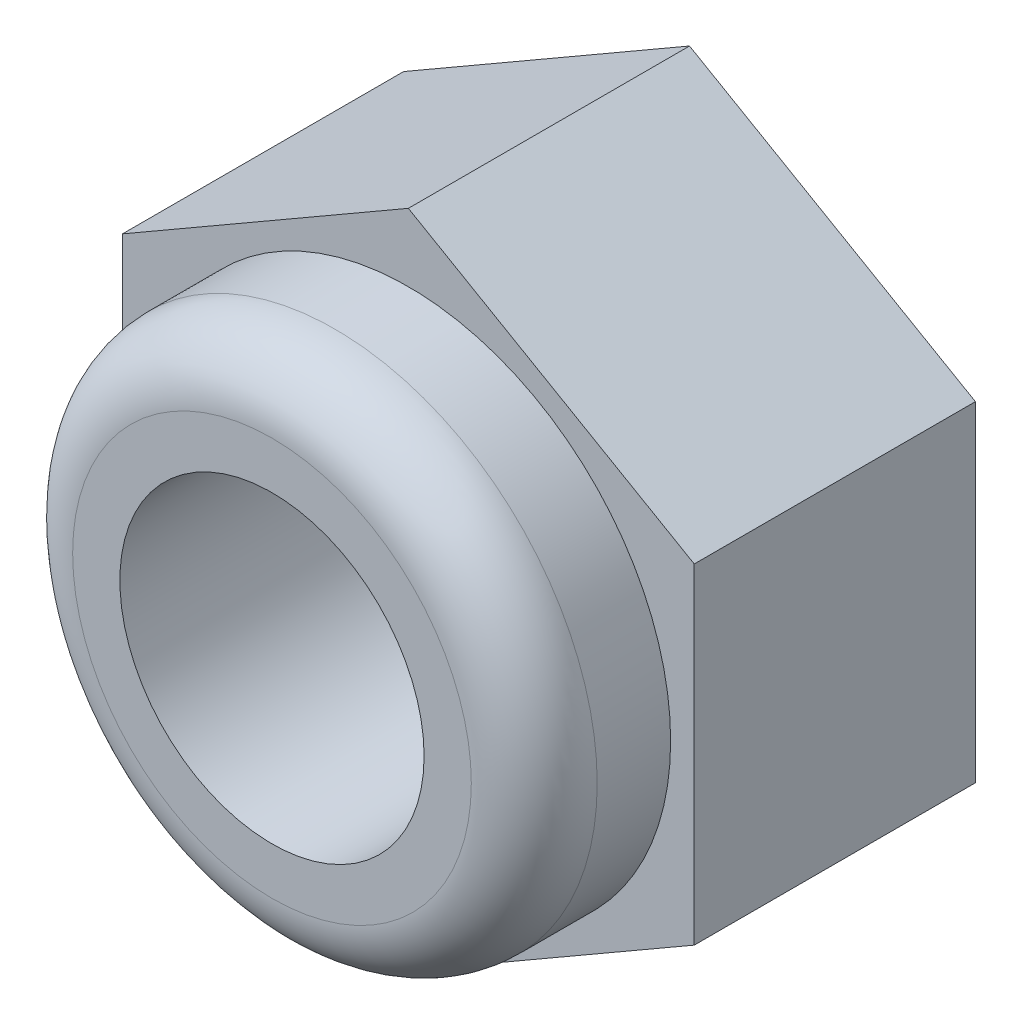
SolidWorks part; units mm, degrees
ref_plane "Plan de face" through (0, 0, 0) normal (0, 0, 1) x (1, 0, 0)
ref_plane "Plan de dessus" through (0, 0, 0) normal (0, 1, 0) x (1, 0, 0)
ref_plane "Plan de droite" through (0, 0, 0) normal (1, 0, 0) x (0, 0, -1)
sketch "Esquisse1" plane through (0, 0, 0) normal (0, 0, 1) x (1, 0, 0)
  line L1 (0, 3.1466) -> (-2.725, 1.5733)
  line L2 (-2.725, 1.5733) -> (-2.725, -1.5733)
  line L3 (-2.725, -1.5733) -> (0, -3.1466)
  line L4 (0, -3.1466) -> (2.725, -1.5733)
  line L5 (2.725, -1.5733) -> (2.725, 1.5733)
  line L6 (2.725, 1.5733) -> (0, 3.1466)
  circle A0 centre (0, 0) radius 2.725 construction
  circle A1 centre (0, 0) radius 1.45
extrude "Extrusion1" add sketch "Esquisse1" along normal blind 2.68
sketch "Esquisse2" plane through (0, 0, 2.68) normal (0, 0, 1) x (1, 0, 0)
  circle A0 centre (0, 0) radius 1.45
  circle A1 centre (0, 0) radius 2.5
extrude "Boss.-Extru.1" add sketch "Esquisse2" along normal blind 1.3
fillet "Congé1" radius 0.6 1 edges at (2.5, 0, 3.98)
